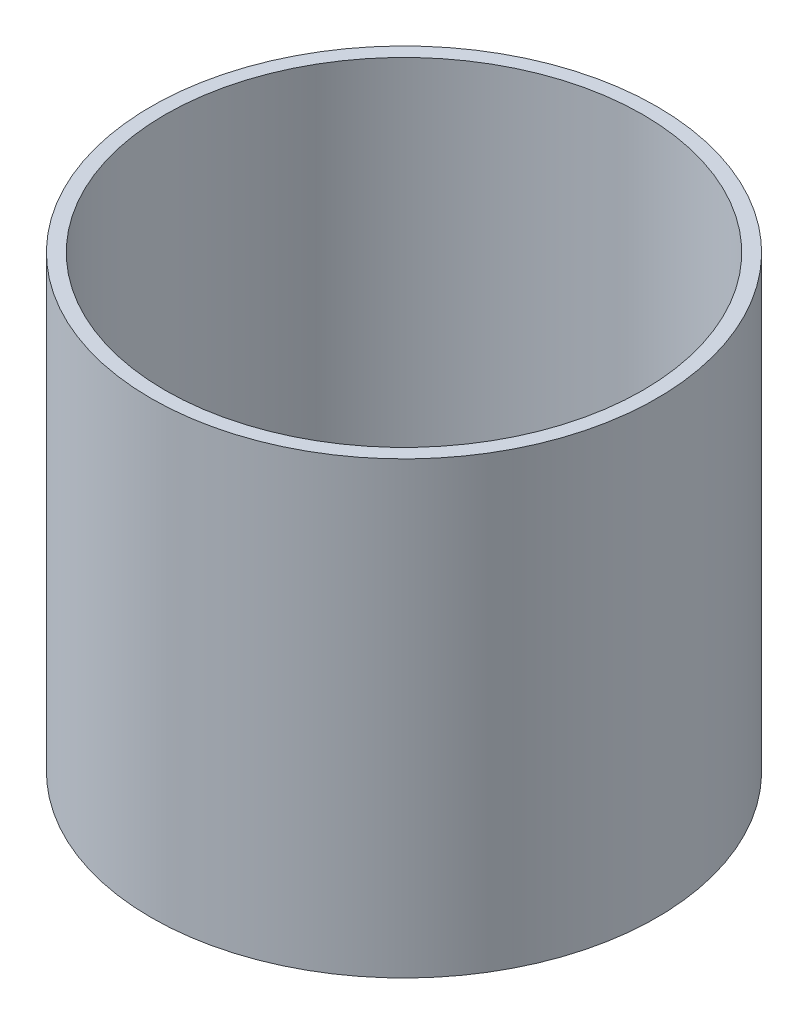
SolidWorks part; units mm, degrees
ref_plane "Front Plane" through (0, 0, 0) normal (0, 0, 1) x (1, 0, 0)
ref_plane "Top Plane" through (0, 0, 0) normal (0, 1, 0) x (1, 0, 0)
ref_plane "Right Plane" through (0, 0, 0) normal (1, 0, 0) x (0, 0, -1)
sketch "Sketch1" plane through (0, 0, 0) normal (0, 1, 0) x (1, 0, 0)
  circle A0 centre (0, 0) radius 90
  circle A1 centre (0, 0) radius 85
  dimension "D1" = 180
  dimension "D2" = 170
extrude "Boss-Extrude1" add sketch "Sketch1" along normal blind 160
ref_plane "Plane1" through (0, 160, 0) normal (0, 1, 0) x (1, 0, 0)
sketch "Sketch2" plane through (0, 160, 0) normal (0, 1, 0) x (1, 0, 0)
  circle A0 centre (0, 0) radius 90
  dimension "D1" = 180
ref_plane "Plane2" through (0, 0, 0) normal (0, -1, 0) x (-1, 0, 0)
